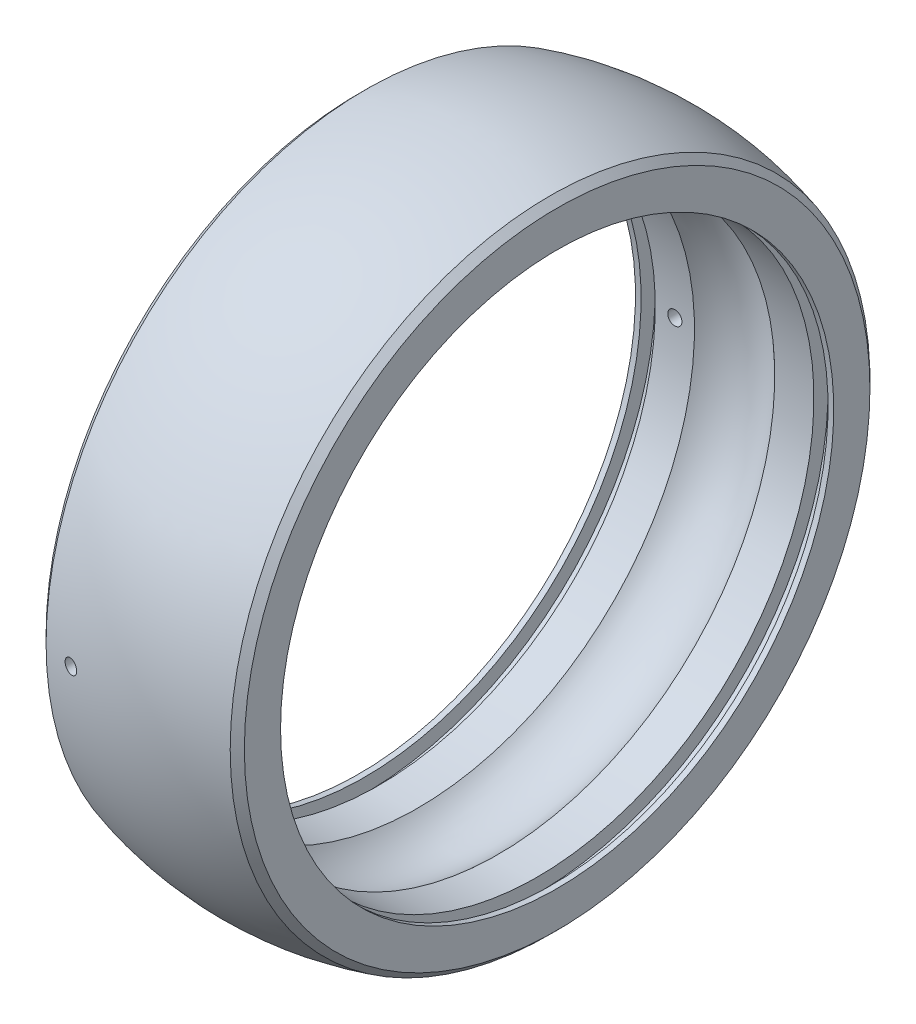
SolidWorks part; units mm, degrees
ref_plane "Front" through (0, 0, 0) normal (0, 0, 1) x (1, 0, 0)
ref_plane "Top" through (0, 0, 0) normal (0, 1, 0) x (1, 0, 0)
ref_plane "Right" through (0, 0, 0) normal (1, 0, 0) x (0, 0, -1)
sketch "Esquisse1" plane through (0, 0, 0) normal (0, 0, 1) x (1, 0, 0)
  line L0 (-13.5635, 52.5) -> (11.5281, 52.5) construction
  line L2 (-7, 74.5832) -> (-7, 72.0283)
  line L4 (-6.5, 75.0832) -> (-7, 74.5832)
  line L6 (7, 74.5832) -> (6.5, 75.0832)
  line L10 (7, 72.0283) -> (6.6, 72.0283)
  line L12 (6.6, 73.0283) -> (6.6, 72.0283)
  line L14 (6.6, 73.0283) -> (5.6, 73.0283)
  line L18 (5.6, 72.0283) -> (2.8344, 72.0283)
  line L20 (-2.8344, 72.0283) -> (-5.6, 72.0283)
  line L22 (-5.6, 73.0283) -> (-5.6, 72.0283)
  line L24 (-5.6, 73.0283) -> (-6.6, 73.0283)
  line L26 (-6.6, 72.0283) -> (-6.6, 73.0283)
  line L28 (-6.6, 72.0283) -> (-7, 72.0283)
  line L29 (7, 72.0283) -> (7, 74.5832)
  line L31 (5.6, 72.0283) -> (5.6, 73.0283)
  arc A1 (2.8344, 72.0283) -> (-2.8344, 72.0283) centre (0, 69.25) ccw
revolve "Révolution2" add sketch "Esquisse1" angle 360 about L0
sketch "Esquisse2" plane through (0, 0, 0) normal (0, 0, 1) x (1, 0, 0)
  line L2 (6.5, 52.5) -> (-9.9602, 52.5) construction
  line L3 (6.5, 75.0832) -> (6.5, 29.9168) construction
  circle A0 centre (-4.2169, 52.5) radius 0.5
  dimension "D1" = 1
extrude "Enlèv. mat.-Extru.1" cut sketch "Esquisse2" against normal through all and the other way through all
